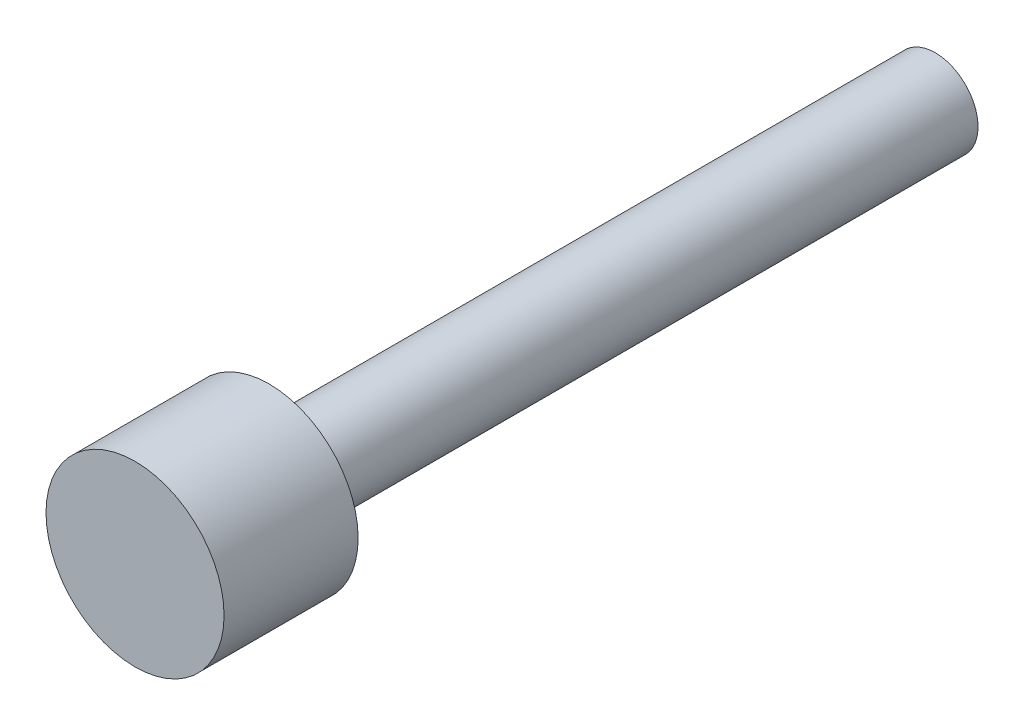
SolidWorks part; units mm, degrees
ref_plane "Front Plane" through (0, 0, 0) normal (0, 0, 1) x (1, 0, 0)
ref_plane "Top Plane" through (0, 0, 0) normal (0, 1, 0) x (1, 0, 0)
ref_plane "Right Plane" through (0, 0, 0) normal (1, 0, 0) x (0, 0, -1)
sketch "Sketch1" plane through (0, 0, 0) normal (0, 0, 1) x (1, 0, 0)
  circle A0 centre (0, 0) radius 8.5
extrude "Boss-Extrude1" add sketch "Sketch1" against normal up to surface (12.8 mm away)
sketch "Sketch2" plane through (0, 0, -12.8) normal (0, 0, -1) x (-1, 0, 0)
  circle A0 centre (0, 0) radius 4.08
  dimension "D1" = 8.16
extrude "Boss-Extrude2" add sketch "Sketch2" along normal up to surface (63.6 mm away)
